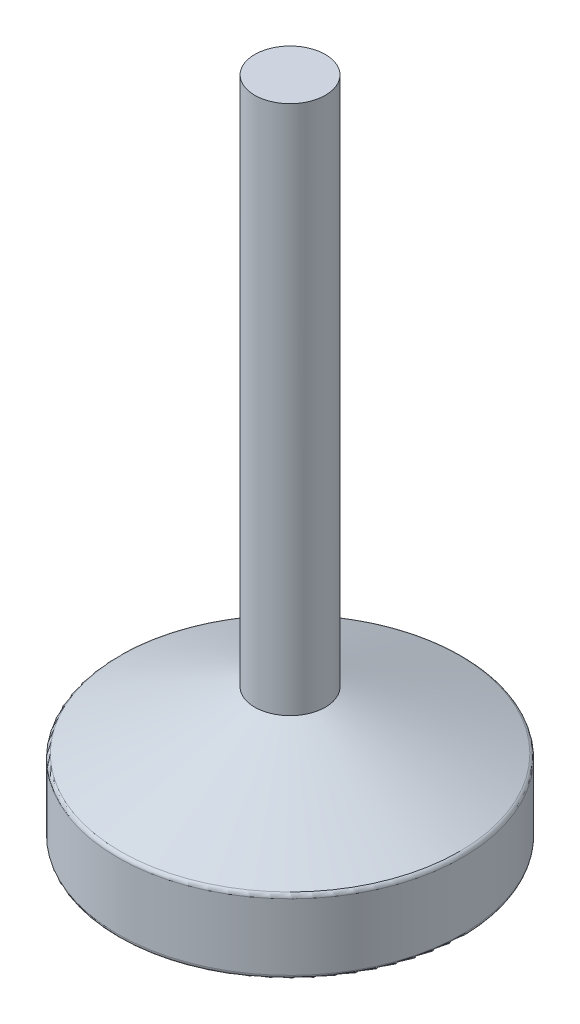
SolidWorks part; units mm, degrees
ref_plane "前基準面" through (0, 0, 0) normal (0, 0, 1) x (1, 0, 0)
ref_plane "上基準面" through (0, 0, 0) normal (0, 1, 0) x (1, 0, 0)
ref_plane "右基準面" through (0, 0, 0) normal (1, 0, 0) x (0, 0, -1)
sketch "草圖1" plane through (0, 0, 0) normal (0, 0, 1) x (1, 0, 0)
  line L0 (0, 0) -> (0, -150)
  line L1 (0, -150) -> (37.9995, -150)
  line L2 (38.9995, -149) -> (38.9995, -134)
  line L3 (38.3949, -133.0815) -> (8, -120)
  line L4 (8, -120) -> (8, 0)
  line L5 (8, 0) -> (0, 0)
  line L6 (0, 10.3606) -> (0, -181.1566) construction
  arc A0 (38.9995, -134) -> (38.3949, -133.0815) centre (37.9995, -134) ccw
  arc A1 (37.9995, -150) -> (38.9995, -149) centre (37.9995, -149) ccw
  dimension "D3" = 1
  dimension "D5" = 1
  dimension "D1" = 150
  dimension "D2" = 120
  dimension "D4" = 8
  dimension "D6" = 15
revolve "旋轉1" add sketch "草圖1" angle 360 about L6
